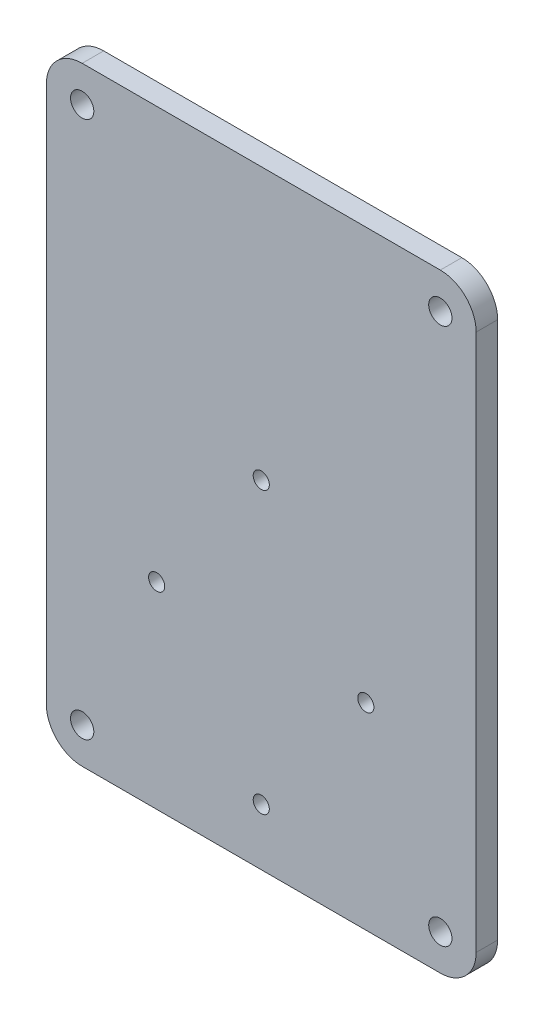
SolidWorks part; units mm, degrees
ref_plane "Спереди (Плоскость XY)" through (0, 0, 0) normal (0, 0, 1) x (1, 0, 0)
ref_plane "Сверху (Плоскость XZ)" through (0, 0, 0) normal (0, 1, 0) x (1, 0, 0)
ref_plane "Справа (Плоскость ZY)" through (0, 0, 0) normal (1, 0, 0) x (0, 0, -1)
sketch "Эскиз1" plane through (0, 0, 0) normal (0, 0, 1) x (1, 0, 0)
  line L1 (-60, 85) -> (60, 85)
  line L2 (-60, 85) -> (-60, -85)
  line L3 (-60, -85) -> (60, -85)
  line L4 (60, 85) -> (60, -85)
  line L5 (-60, 85) -> (60, -85) construction
  line L6 (-60, -85) -> (60, 85) construction
  point P0 (0, 0)
  dimension "D1" = 170
  dimension "D2" = 120
extrude "Бобышка-Вытянуть1" add sketch "Эскиз1" along normal blind 6
sketch "Эскиз2" plane through (0, 0, 6) normal (0, 0, 1) x (1, 0, 0)
  line L0 (0, -30) -> (-50000, -30) construction
  line L2 (-29.2, 9.2) -> (29.2, 9.2) construction
  line L3 (-29.2, 9.2) -> (-29.2, -69.2) construction
  line L4 (-29.2, -69.2) -> (29.2, -69.2) construction
  line L5 (29.2, 9.2) -> (29.2, -69.2) construction
  line L6 (-29.2, 9.2) -> (29.2, -69.2) construction
  line L7 (0, 0) -> (0, 50000) construction
  line L8 (-29.2, -69.2) -> (29.2, 9.2) construction
  circle A0 centre (-29.2, -30) radius 2.25
  circle A1 centre (0, -69.2) radius 2.25
  circle A2 centre (29.2, -30) radius 2.25
  circle A3 centre (0, 9.2) radius 2.25
  point P0 (0, 0)
  point P3 (0, -30)
  dimension "D3" = 4.5
  dimension "D1" = 58.4
  dimension "D2" = 78.4
  dimension "D4" = 30
extrude "Вырез-Вытянуть1" cut sketch "Эскиз2" against normal through all
fillet "Скругление1" radius 10 4 edges at (60, -85, 3) (-60, -85, 3) (-60, 85, 3) (60, 85, 3)
sketch "Эскиз3" plane through (0, 0, 6) normal (0, 0, 1) x (1, 0, 0)
  line L0 (-60, 75) -> (-60, -75) construction
  line L1 (-50, 75) -> (50, 75) construction
  line L2 (-50, 75) -> (-50, -75) construction
  line L3 (-50, -75) -> (50, -75) construction
  line L4 (50, 75) -> (50, -75) construction
  line L5 (-50, 75) -> (50, -75) construction
  line L6 (-50, -75) -> (50, 75) construction
  line L7 (50, 85) -> (-50, 85) construction
  circle A0 centre (-50, 75) radius 3.25
  circle A1 centre (50, 75) radius 3.25
  circle A2 centre (50, -75) radius 3.25
  circle A3 centre (-50, -75) radius 3.25
  point P0 (0, 0)
  dimension "D3" = 6.5
  dimension "D1" = 10
  dimension "D2" = 10
extrude "Вырез-Вытянуть2" cut sketch "Эскиз3" against normal through all
